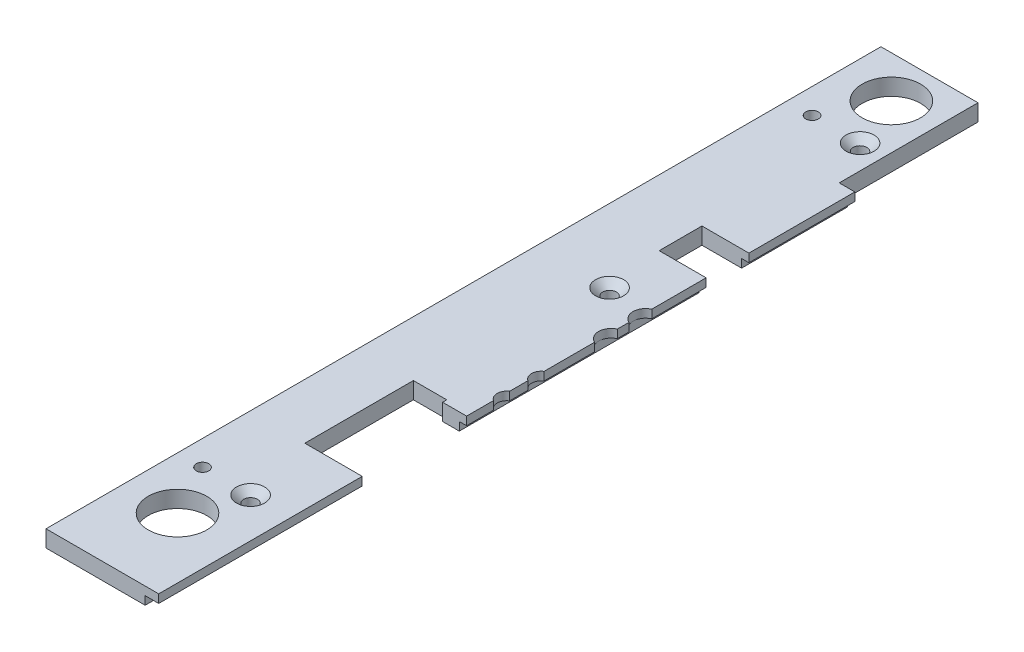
SolidWorks part; units mm, degrees
ref_plane "Frontal" through (0, 0, 0) normal (0, 0, 1) x (1, 0, 0)
ref_plane "Horizontal" through (0, 0, 0) normal (0, 1, 0) x (1, 0, 0)
ref_plane "Profil" through (0, 0, 0) normal (1, 0, 0) x (0, 0, -1)
sketch "Esquisse1" plane through (0, 0, 0) normal (0, 0, 1) x (1, 0, 0)
  line L1 (0, 0) -> (54, 0)
  line L2 (0, 0) -> (0, 8)
  line L3 (0, 8) -> (54, 8)
  line L4 (54, 0) -> (54, 8)
  dimension "D1" = 54
  dimension "D2" = 8
extrude "Base-Extrusion" add sketch "Esquisse1" along normal blind 400
sketch "Esquisse3" plane through (0, 8, 0) normal (0, 1, 0) x (-1, 0, 0)
  line L0 (-28.5, 252.5) -> (-56.5, 252.5) construction
  line L1 (-42.5, 252.5) -> (-61.0493, 252.5)
  line L2 (-42.5, 252.5) -> (-42.5, 250.5)
  line L3 (-42.5, 250.5) -> (-26.5, 250.5)
  line L4 (-26.5, 250.5) -> (-26.5, 302.5)
  line L5 (-26.5, 302.5) -> (-61.0493, 302.5)
  line L6 (-61.0493, 302.5) -> (-61.0493, 252.5)
  line L7 (-28.5, 302.5) -> (-28.5, 252.5) construction
  line L8 (-56.5, 300.5) -> (-28.5, 300.5) construction
  line L9 (-56.5, 245.25) -> (-56.5, 266.75) construction
  line L10 (-54, 400) -> (-54, 0) construction
  line L11 (-54, 117.25) -> (-31.5, 117.25)
  line L12 (-54, 117.25) -> (-54, 137.75)
  line L13 (-54, 137.75) -> (-31.5, 137.75)
  line L14 (-31.5, 117.25) -> (-31.5, 137.75)
  line L15 (-54, 400) -> (0, 400) construction
  line L16 (-33.5, 135.75) -> (-50.5, 135.75) construction
  line L17 (-33.5, 119.25) -> (-33.5, 135.75) construction
  line L18 (-50.5, 119.25) -> (-33.5, 119.25) construction
  line L20 (-54, 0) -> (-46.5, 0)
  line L21 (-54, 0) -> (-54, 66.4929)
  line L22 (-54, 66.4929) -> (-46.5, 66.4929)
  line L23 (-46.5, 0) -> (-46.5, 66.4929)
  circle A0 centre (-56.5, 235.75) radius 4.6
  circle A1 centre (-56.5, 219.25) radius 4.6
  circle A2 centre (-56.5, 185.75) radius 6
  circle A3 centre (-56.5, 169.25) radius 6
  dimension "D5" = 9.2
  dimension "D6" = 9.2
  dimension "D10" = 12
  dimension "D11" = 12
  dimension "D1" = 2
  dimension "D2" = 2
  dimension "D3" = 2
  dimension "D4" = 14
  dimension "D7" = 2
  dimension "D8" = 2
  dimension "D9" = 2
  dimension "D12" = 50
  dimension "D13" = 97.5
extrude "Enlèv. mat.-Extru.1" cut sketch "Esquisse3" against normal through all
sketch "Esquisse4" plane through (0, 0, 400) normal (0, 0, 1) x (1, 0, 0)
  line L1 (54, 0) -> (47.5, 0)
  line L2 (54, 0) -> (54, 4)
  line L3 (54, 4) -> (47.5, 4)
  line L4 (47.5, 0) -> (47.5, 4)
  dimension "D1" = 4
  dimension "D2" = 6.5
extrude "Enlèv. mat.-Extru.2" cut sketch "Esquisse4" against normal up to next
sketch "Esquisse5" plane through (0, 0, 252.5) normal (0, 0, 1) x (1, 0, 0)
  line L0 (54, 4) -> (47.5, 4) construction
  line L1 (54, 0) -> (50.5, 0)
  line L2 (54, 0) -> (54, 4)
  line L3 (54, 4) -> (50.5, 4)
  line L4 (50.5, 0) -> (50.5, 4)
  dimension "D1" = 3.5
extrude "Enlèv. mat.-Extru.3" cut sketch "Esquisse5" against normal through all
sketch "Esquisse6" plane through (0, 8, 0) normal (0, 1, 0) x (-1, 0, 0)
  circle A0 centre (-25, 20) radius 14
  circle A1 centre (-25, 362) radius 14
  dimension "D1" = 28
  dimension "D2" = 28
extrude "Enlèv. mat.-Extru.4" cut sketch "Esquisse6" against normal through all
hole_wizard "Fraisage pour vis à tête fraisée à 6 pans creux M61" positions "Esquisse8" profile "Esquisse7" countersink size "M6" standard "Ansi Métrique"
sketch "Esquisse8" plane through (0, 8, 0) normal (0, 1, 0) x (-1, 0, 0)
  circle A0 centre (-25, 20) radius 14 construction
  circle A1 centre (-25, 362) radius 14 construction
  point P0 (-35, 45)
  point P3 (-35, 337)
  point P4 (-35, 165)
  dimension "D2" = 25
  dimension "D1" = 10
  dimension "D3" = 120
  dimension "D4" = 25
sketch "Esquisse7" plane through (35, 8, 45) normal (1, 0, 0) x (0, 0, 1)
  line L0 (0, 0) -> (0, 8)
  line L1 (0, 8) -> (3.3, 8)
  line L2 (3.3, 8) -> (3.3, 3.42)
  line L3 (3.3, 3.42) -> (6.72, 0)
  line L5 (6.72, 0) -> (0, 0)
  line L6 (-3.3, 3.42) -> (-6.72, 0) construction
  line L11 (0, -6.35) -> (0, 107.95) construction
  dimension "Diamètre du perçage jusqu'au prochain" = 6.6
  dimension "Profondeur du perçage jusqu'au prochain" = 8
  dimension "Diamètre du fraisage entrant" = 13.44
  dimension "Angle du fraisage entrant" = 90
sketch "Esquisse9" plane through (0, 8, 0) normal (0, 1, 0) x (-1, 0, 0)
  line L0 (0, 400) -> (0, 0) construction
  circle A0 centre (-12, 337) radius 3
  circle A1 centre (-12, 45) radius 3
  dimension "D1" = 6
  dimension "D2" = 12
extrude "Enlèv. mat.-Extru.5" cut sketch "Esquisse9" against normal through all
